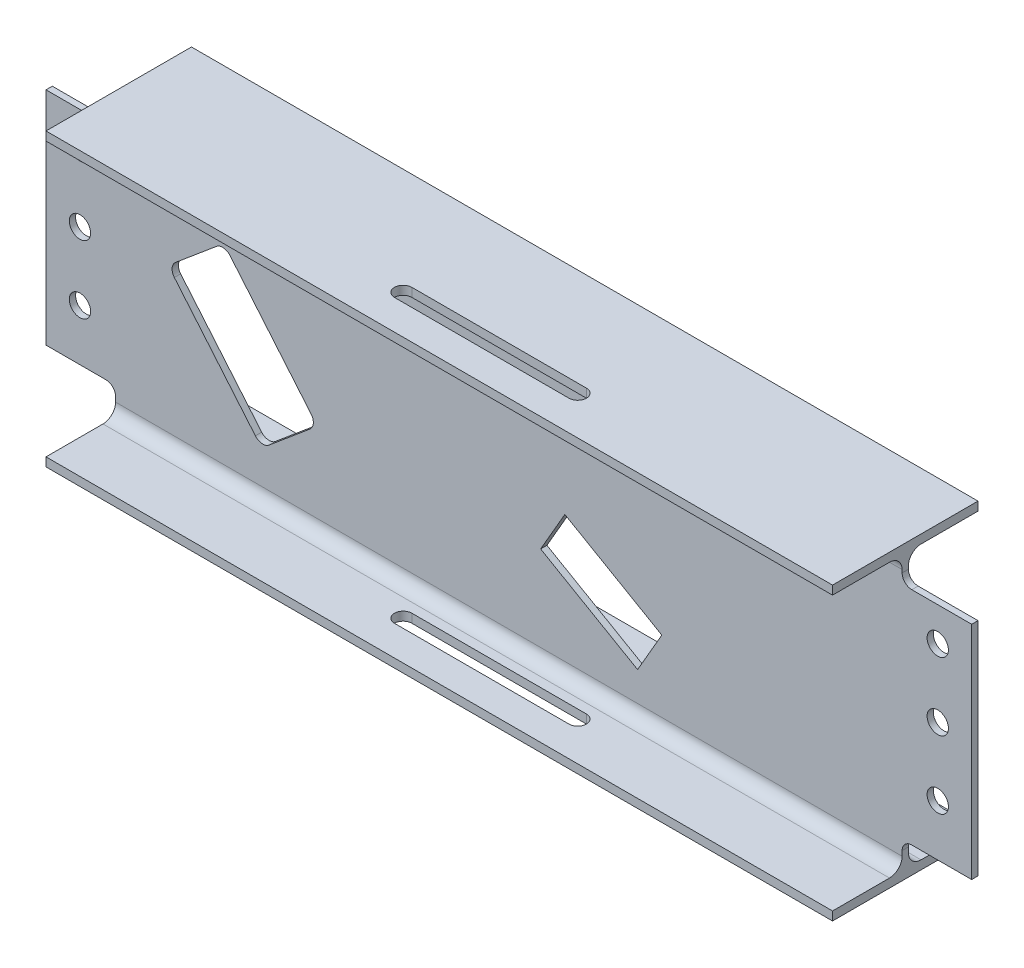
SolidWorks part; units mm, degrees
ref_plane "Front Plane" through (0, 0, 0) normal (0, 0, 1) x (1, 0, 0)
ref_plane "Top Plane" through (0, 0, 0) normal (0, 1, 0) x (1, 0, 0)
ref_plane "Right Plane" through (0, 0, 0) normal (1, 0, 0) x (0, 0, -1)
sketch "Member Sketch" plane through (0, 0, 0) normal (0, 1, 0) x (1, 0, 0)
  line L0 (0, 0) -> (1000, 0)
  line L2 (0, 0) -> (1000, 0) construction
other "Structural Member1"
ref_plane "Plane1" through (0, 0, 0) normal (1, 0, 0) x (0, 0, -1)
sketch "Sketch116" plane through (0, -150, 0) normal (1, 0, 0) x (0, 0, -1)
  line L0 (-75, 150) -> (75, 150)
  line L1 (75, 150) -> (75, 141)
  line L2 (75, 141) -> (16.25, 141)
  line L3 (3.25, 128) -> (3.25, -128)
  line L4 (-3.25, 0) -> (3.25, 0) construction
  line L5 (0, -150) -> (0, 150) construction
  line L6 (-3.25, 128) -> (-3.25, -128)
  line L7 (-75, 141) -> (-16.25, 141)
  line L8 (-75, 150) -> (-75, 141)
  line L9 (-75, -150) -> (-75, -141)
  line L10 (-75, -141) -> (-16.25, -141)
  line L11 (75, -141) -> (16.25, -141)
  line L12 (75, -150) -> (75, -141)
  line L13 (-75, -150) -> (75, -150)
  line L14 (-75, 141) -> (-75, -141) construction
  line L15 (75, 141) -> (75, -141) construction
  line L16 (-3.25, 0) -> (-75, 0) construction
  line L17 (3.25, 0) -> (75, 0) construction
  arc A0 (16.25, 141) -> (3.25, 128) centre (16.25, 128) ccw
  arc A3 (-16.25, 141) -> (-3.25, 128) centre (-16.25, 128) cw
  arc A4 (-16.25, -141) -> (-3.25, -128) centre (-16.25, -128) ccw
  arc A7 (16.25, -141) -> (3.25, -128) centre (16.25, -128) cw
  point P18 (0, 0)
  dimension "Root Radius(r)" = 13
  dimension "Section Depth(D)" = 300
  dimension "Flange Width(B)" = 150
  dimension "Web Thickness(t)" = 6.5
  dimension "Flange Thickness(T)" = 9
sketch "Sketch2" plane through (0, 0, 0) normal (0, 1, 0) x (1, 0, 0)
  line L0 (500, 0) -> (1500, 0) construction
  line L1 (0, -82.5) -> (0, 82.5) construction
  line L2 (-165, 0) -> (165, 0) construction
  text T0 "H 300 x 150 x 6.5 x 9" font "Century Gothic" height 30
  dimension "D1" = 500
  dimension "D2" = 1000
extrude "MARKING" [suppressed] cut sketch "Sketch2" against normal blind 1
other "0008-AABE004-CN02-FP01D01-1 - MEMBER2 CAVITY"
other "0008-AABE004<1>@0008-AA/0008-AABE004-CN02-FP01<1>@0008-AABE004/0008-AABE004-CN02-FP01D01<1>@0008-AABE004-CN02-FP011"
other "0008-AABE004-CN02-FP01D02-1 - MEMBER2 CAVITY"
other "0008-AABE004<1>@0008-AA/0008-AABE004-CN02-FP01<1>@0008-AABE004/0008-AABE004-CN02-FP01D02<1>@0008-AABE004-CN02-FP011"
other "0008-AABE002-CN01-FP02D01-1 - MEMBER2 CAVITY"
other "0008-AABE002<1>@0008-AA/0008-AABE002-CN01-FP02<1>@0008-AABE002/0008-AABE002-CN01-FP02D01<1>@0008-AABE002-CN01-FP021"
other "0008-AABE002-CN01-FP02D02-1 - MEMBER2 CAVITY"
other "0008-AABE002<1>@0008-AA/0008-AABE002-CN01-FP02<1>@0008-AABE002/0008-AABE002-CN01-FP02D02<1>@0008-AABE002-CN01-FP021"
sketch "Sketch12" plane through (0, 0, -3.25) normal (0, 0, -1) x (-1, 0, 0)
  line L0 (-657.75, -204.4338) -> (-557.75, -146.6987)
  line L1 (-657.75, -204.4338) -> (-632.75, -247.735)
  line L2 (-557.75, -146.6987) -> (-532.75, -190)
  line L3 (-632.75, -247.735) -> (-532.75, -190)
  line L4 (-22.75, -263) -> (-22.75, -35) construction
  line L5 (-905.5, -300) -> (-94.5, -300) construction
  line L6 (-905.5, 0) -> (-94.5, 0) construction
  line L7 (-296.1053, -187.8046) -> (-212.5429, -88.2188)
  line L8 (-294.8727, -201.8929) -> (-252.7403, -237.2462)
  line L9 (-198.4546, -86.9862) -> (-156.3221, -122.3396)
  line L10 (-238.6519, -236.0137) -> (-155.0896, -136.4279)
  arc A0 (-238.6519, -236.0137) -> (-252.7403, -237.2462) centre (-246.3124, -229.5858) cw
  arc A1 (-294.8727, -201.8929) -> (-296.1053, -187.8046) centre (-288.4448, -194.2325) cw
  arc A2 (-198.4546, -86.9862) -> (-212.5429, -88.2188) centre (-204.8824, -94.6467) ccw
  arc A3 (-156.3221, -122.3396) -> (-155.0896, -136.4279) centre (-162.75, -130) cw
  dimension "D6" = 10
  dimension "D1" = 510
  dimension "D2" = 100
  dimension "D3" = 30
  dimension "D4" = 50
  dimension "D5" = 190
  dimension "D7" = 140
  dimension "D8" = 50
  dimension "D9" = 130
  dimension "D10" = 75
  dimension "D11" = 150
extrude "Cut-Extrude1" cut sketch "Sketch12" against normal through all
sketch "Sketch13" plane through (0, 0, 0) normal (0, 1, 0) x (1, 0, 0)
  line L0 (422.75, -35) -> (602.75, -35) construction
  line L1 (422.75, -26) -> (602.75, -26)
  line L2 (422.75, -44) -> (602.75, -44)
  line L3 (-165, 0) -> (165, 0) construction
  arc A0 (422.75, -26) -> (422.75, -44) centre (422.75, -35) ccw
  arc A1 (602.75, -44) -> (602.75, -26) centre (602.75, -35) ccw
  point P2 (512.75, -35)
  dimension "D1" = 18
  dimension "D2" = 180
  dimension "D3" = 400
  dimension "D4" = 35
extrude "Cut-Extrude2" cut sketch "Sketch13" against normal through all
